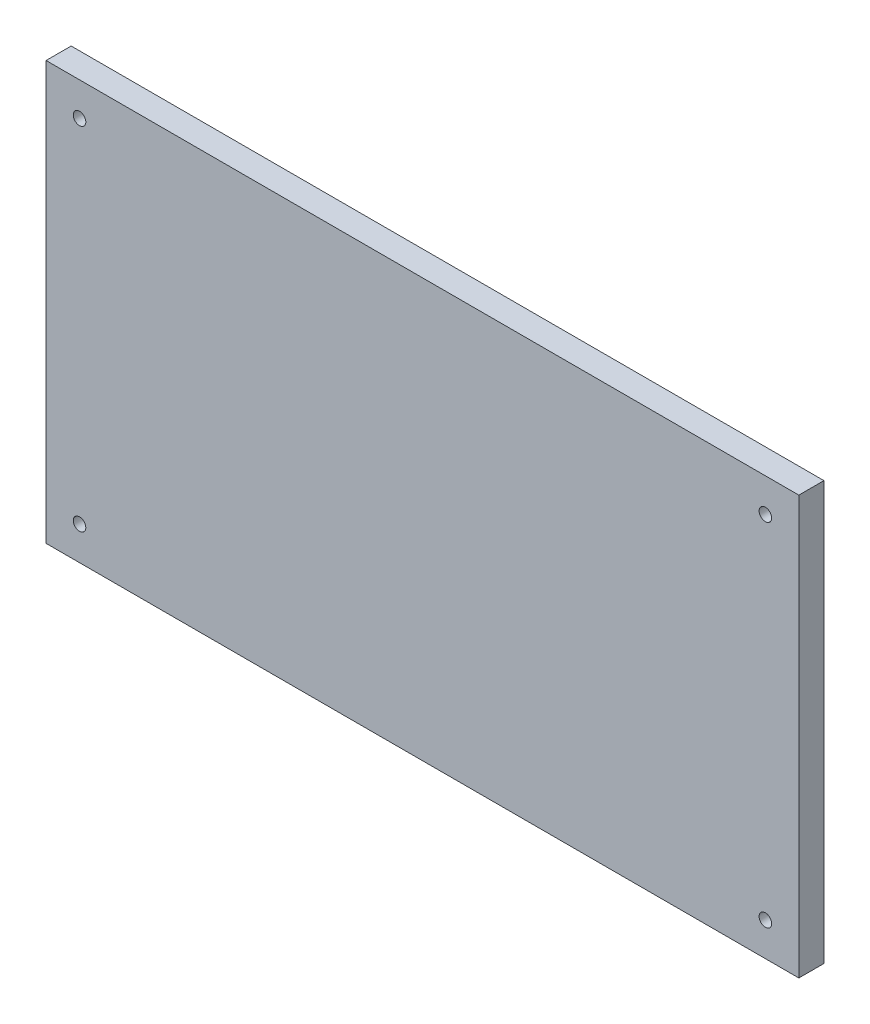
SolidWorks part; units mm, degrees
ref_plane "Front Plane" through (0, 0, 0) normal (0, 0, 1) x (1, 0, 0)
ref_plane "Top Plane" through (0, 0, 0) normal (0, 1, 0) x (1, 0, 0)
ref_plane "Right Plane" through (0, 0, 0) normal (1, 0, 0) x (0, 0, -1)
sketch "Sketch1" plane through (0, 0, 0) normal (0, 0, 1) x (1, 0, 0)
  line L1 (-270.4327, 149.399) -> (179.5673, 149.399)
  line L2 (-270.4327, 149.399) -> (-270.4327, -100.601)
  line L3 (-270.4327, -100.601) -> (179.5673, -100.601)
  line L4 (179.5673, 149.399) -> (179.5673, -100.601)
  dimension "D1" = 450
  dimension "D2" = 250
extrude "Boss-Extrude1" add sketch "Sketch1" along normal blind 15
sketch "Sketch4" plane through (0, 0, 0) normal (0, 0, 1) x (1, 0, 0)
  line L0 (179.5673, 149.399) -> (-270.4327, -100.601) construction
  line L1 (-270.4327, 149.399) -> (179.5673, -100.601) construction
  line L3 (-270.4327, 149.399) -> (179.5673, 149.399) construction
  line L4 (179.5673, 149.399) -> (179.5673, -100.601) construction
  line L5 (-45.4327, 24.399) -> (179.5673, 24.399) construction
  line L6 (-45.4327, 24.399) -> (-45.4327, 149.399) construction
  line L7 (-45.4327, 24.399) -> (-45.4327, -100.601) construction
  line L8 (-270.4327, -100.601) -> (179.5673, -100.601) construction
  circle A0 centre (159.5673, 129.399) radius 3.75
  circle A4 centre (159.5673, -80.601) radius 3.75
  circle A5 centre (-250.4327, -80.601) radius 3.75
  circle A6 centre (-250.4327, 129.399) radius 3.75
  dimension "D1" = 7.5
  dimension "D5" = 20
  dimension "D6" = 20
extrude "Cut-Extrude1" cut sketch "Sketch4" along normal blind 65
